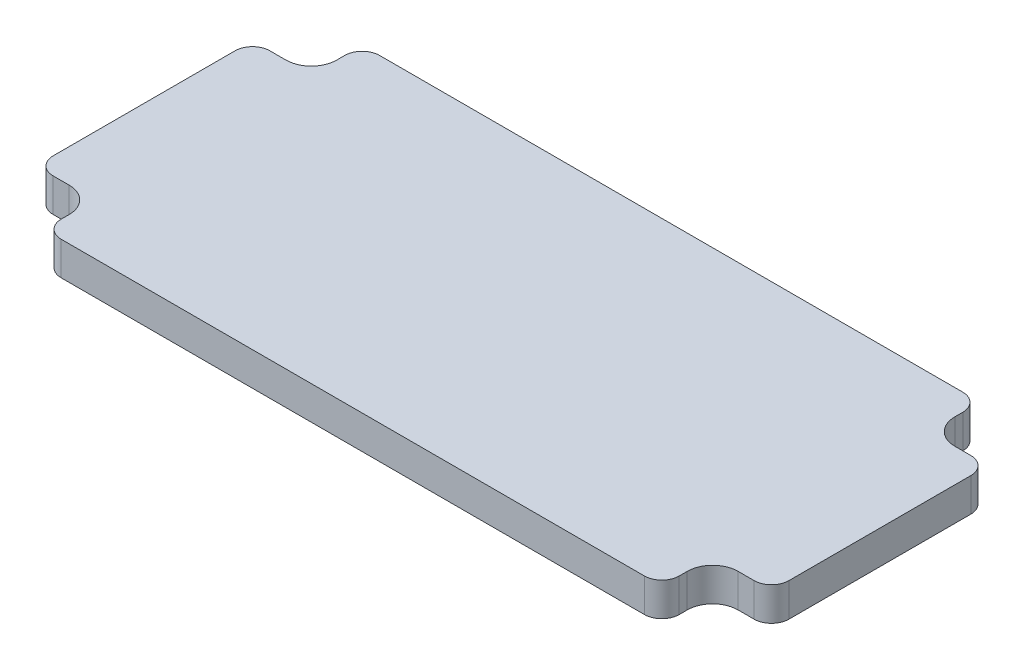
SolidWorks part; units mm, degrees
ref_plane "Front Plane" through (0, 0, 0) normal (0, 0, 1) x (1, 0, 0)
ref_plane "Top Plane" through (0, 0, 0) normal (0, 1, 0) x (1, 0, 0)
ref_plane "Right Plane" through (0, 0, 0) normal (1, 0, 0) x (0, 0, -1)
sketch "Sketch1" plane through (0, 0, 0) normal (0, 1, 0) x (1, 0, 0)
  line L0 (-58.674, 25.4) -> (-58.674, 26.924)
  line L1 (0, 0) -> (-69.85, 0)
  line L2 (0, 0) -> (0, 30.226)
  line L3 (0, 30.226) -> (-55.372, 30.226)
  line L4 (-69.85, 0) -> (-69.85, 17.272)
  line L5 (-63.5, 20.574) -> (-66.548, 20.574)
  arc A0 (-63.5, 20.574) -> (-58.674, 25.4) centre (-63.5, 25.4) ccw
  arc A1 (-55.372, 30.226) -> (-58.674, 26.924) centre (-55.372, 26.924) ccw
  arc A2 (-69.85, 17.272) -> (-66.548, 20.574) centre (-66.548, 17.272) cw
  dimension "D3" = 30.226
  dimension "D5" = 4.826
  dimension "D6" = 3.302
  dimension "D1" = 69.85
  dimension "D2" = 63.5
  dimension "D4" = 25.4
extrude "Boss-Extrude1" add sketch "Sketch1" along normal blind 6.35
mirror "Mirror1" about plane through (0, 0, 0) normal (0, 0, 1) of "Boss-Extrude1"
mirror "Mirror3" about plane through (0, 0, 0) normal (1, 0, 0) of "Mirror1", "Boss-Extrude1"
